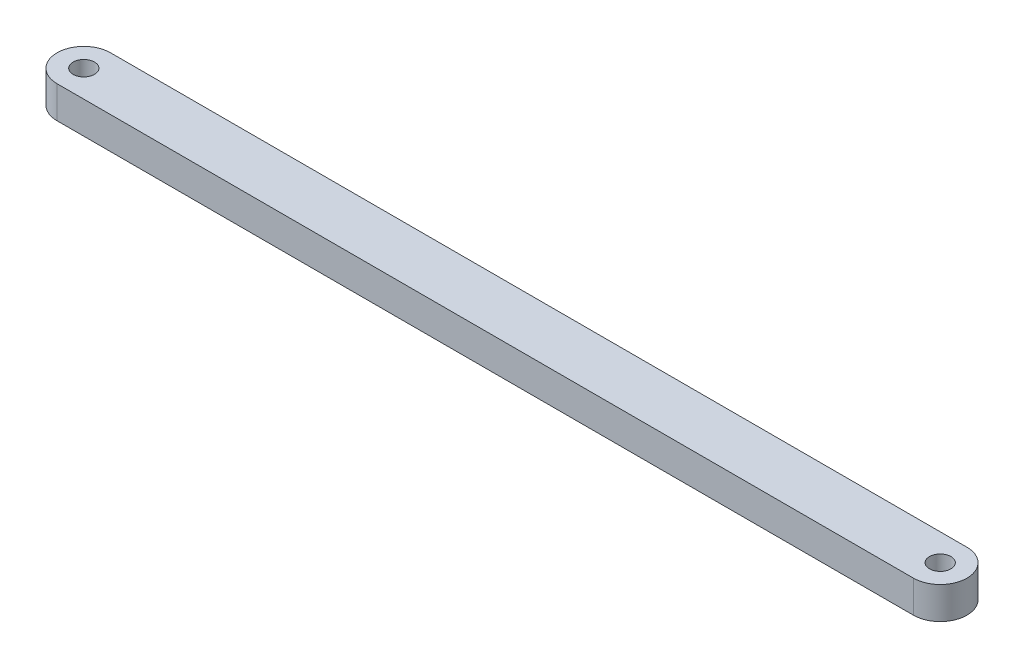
SolidWorks part; units mm, degrees
ref_plane "Front Plane" through (0, 0, 0) normal (0, 0, 1) x (1, 0, 0)
ref_plane "Top Plane" through (0, 0, 0) normal (0, 1, 0) x (1, 0, 0)
ref_plane "Right Plane" through (0, 0, 0) normal (1, 0, 0) x (0, 0, -1)
sketch "Sketch1" plane through (0, 0, 0) normal (0, 1, 0) x (1, 0, 0)
  line L0 (-400, 0) -> (400, 0) construction
  line L1 (-400, 25) -> (400, 25)
  line L2 (-400, -25) -> (400, -25)
  arc A0 (-400, 25) -> (-400, -25) centre (-400, 0) ccw
  arc A1 (400, -25) -> (400, 25) centre (400, 0) ccw
  circle A2 centre (-400, 0) radius 10
  circle A3 centre (400, 0) radius 10
  point P3 (0, 0)
  dimension "D2" = 25
  dimension "D3" = 20
  dimension "D1" = 800
extrude "Boss-Extrude1" add sketch "Sketch1" along normal blind 30
